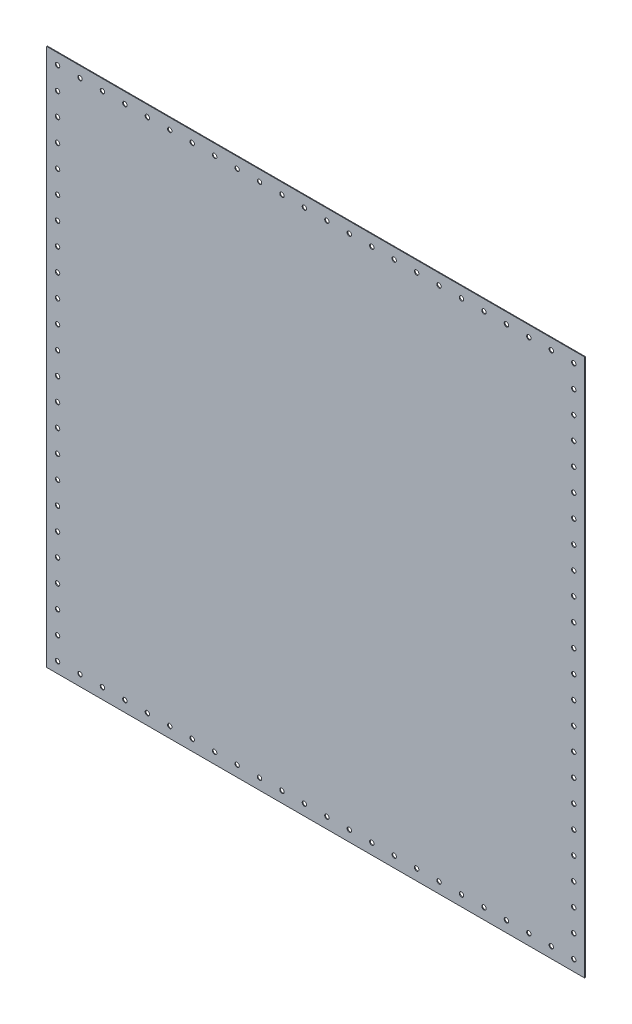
SolidWorks part; units mm, degrees
ref_plane "Front Plane" through (0, 0, 0) normal (0, 0, 1) x (1, 0, 0)
ref_plane "Top Plane" through (0, 0, 0) normal (0, 1, 0) x (1, 0, 0)
ref_plane "Right Plane" through (0, 0, 0) normal (1, 0, 0) x (0, 0, -1)
sketch "Sketch1" plane through (0, 0, 0) normal (0, 0, 1) x (1, 0, 0)
  line L1 (-598.4875, 598.4875) -> (598.4875, 598.4875)
  line L2 (-598.4875, 598.4875) -> (-598.4875, -598.4875)
  line L3 (-598.4875, -598.4875) -> (598.4875, -598.4875)
  line L4 (598.4875, 598.4875) -> (598.4875, -598.4875)
  point P4 (0, 598.4875)
  point P5 (-598.4875, 0)
  dimension "D1" = 1196.975
  dimension "D2" = 1196.975
sketch "Sketch2" plane through (0, 0, 0) normal (0, 0, 1) x (1, 0, 0)
  line L0 (-598.4875, 598.4875) -> (-598.4875, -598.4875) construction
  line L1 (-598.4875, -598.4875) -> (598.4875, -598.4875) construction
  line L2 (598.4875, 598.4875) -> (598.4875, -598.4875) construction
  circle A1 centre (574.3575, -574.3575) radius 4.9022
  circle A2 centre (-574.3575, -574.3575) radius 4.9022
  circle A3 centre (574.3575, -524.4134) radius 4.9022
  circle A4 centre (-574.3575, -524.4134) radius 4.9022
  circle A5 centre (574.3575, -474.4692) radius 4.9022
  circle A6 centre (-574.3575, -474.4692) radius 4.9022
  circle A7 centre (574.3575, -424.5251) radius 4.9022
  circle A8 centre (-574.3575, -424.5251) radius 4.9022
  circle A9 centre (574.3575, -374.581) radius 4.9022
  circle A10 centre (-574.3575, -374.581) radius 4.9022
  circle A11 centre (574.3575, -324.6368) radius 4.9022
  circle A12 centre (-574.3575, -324.6368) radius 4.9022
  circle A13 centre (574.3575, -274.6927) radius 4.9022
  circle A14 centre (-574.3575, -274.6927) radius 4.9022
  circle A15 centre (574.3575, -224.7486) radius 4.9022
  circle A16 centre (-574.3575, -224.7486) radius 4.9022
  circle A17 centre (574.3575, -174.8045) radius 4.9022
  circle A18 centre (-574.3575, -174.8045) radius 4.9022
  circle A19 centre (574.3575, -124.8603) radius 4.9022
  circle A20 centre (-574.3575, -124.8603) radius 4.9022
  circle A21 centre (574.3575, -74.9162) radius 4.9022
  circle A22 centre (-574.3575, -74.9162) radius 4.9022
  circle A23 centre (574.3575, -24.9721) radius 4.9022
  circle A24 centre (-574.3575, -24.9721) radius 4.9022
  circle A25 centre (574.3575, 24.9721) radius 4.9022
  circle A26 centre (-574.3575, 24.9721) radius 4.9022
  circle A27 centre (574.3575, 74.9162) radius 4.9022
  circle A28 centre (-574.3575, 74.9162) radius 4.9022
  circle A29 centre (574.3575, 124.8603) radius 4.9022
  circle A30 centre (-574.3575, 124.8603) radius 4.9022
  circle A31 centre (574.3575, 174.8045) radius 4.9022
  circle A32 centre (-574.3575, 174.8045) radius 4.9022
  circle A33 centre (574.3575, 224.7486) radius 4.9022
  circle A34 centre (-574.3575, 224.7486) radius 4.9022
  circle A35 centre (574.3575, 274.6927) radius 4.9022
  circle A36 centre (-574.3575, 274.6927) radius 4.9022
  circle A37 centre (574.3575, 324.6368) radius 4.9022
  circle A38 centre (-574.3575, 324.6368) radius 4.9022
  circle A39 centre (574.3575, 374.581) radius 4.9022
  circle A40 centre (-574.3575, 374.581) radius 4.9022
  circle A41 centre (574.3575, 424.5251) radius 4.9022
  circle A42 centre (-574.3575, 424.5251) radius 4.9022
  circle A43 centre (574.3575, 474.4692) radius 4.9022
  circle A44 centre (-574.3575, 474.4692) radius 4.9022
  circle A45 centre (574.3575, 524.4134) radius 4.9022
  circle A46 centre (-574.3575, 524.4134) radius 4.9022
  circle A47 centre (574.3575, 574.3575) radius 4.9022
  circle A48 centre (-574.3575, 574.3575) radius 4.9022
  circle A49 centre (-524.4134, -574.3575) radius 4.9022
  circle A50 centre (-524.4134, 574.3575) radius 4.9022
  circle A51 centre (-474.4692, -574.3575) radius 4.9022
  circle A52 centre (-474.4692, 574.3575) radius 4.9022
  circle A53 centre (-424.5251, -574.3575) radius 4.9022
  circle A54 centre (-424.5251, 574.3575) radius 4.9022
  circle A55 centre (-374.581, -574.3575) radius 4.9022
  circle A56 centre (-374.581, 574.3575) radius 4.9022
  circle A57 centre (-324.6368, -574.3575) radius 4.9022
  circle A58 centre (-324.6368, 574.3575) radius 4.9022
  circle A59 centre (-274.6927, -574.3575) radius 4.9022
  circle A60 centre (-274.6927, 574.3575) radius 4.9022
  circle A61 centre (-224.7486, -574.3575) radius 4.9022
  circle A62 centre (-224.7486, 574.3575) radius 4.9022
  circle A63 centre (-174.8045, -574.3575) radius 4.9022
  circle A64 centre (-174.8045, 574.3575) radius 4.9022
  circle A65 centre (-124.8603, -574.3575) radius 4.9022
  circle A66 centre (-124.8603, 574.3575) radius 4.9022
  circle A67 centre (-74.9162, -574.3575) radius 4.9022
  circle A68 centre (-74.9162, 574.3575) radius 4.9022
  circle A69 centre (-24.9721, -574.3575) radius 4.9022
  circle A70 centre (-24.9721, 574.3575) radius 4.9022
  circle A71 centre (24.9721, -574.3575) radius 4.9022
  circle A72 centre (24.9721, 574.3575) radius 4.9022
  circle A73 centre (74.9162, -574.3575) radius 4.9022
  circle A74 centre (74.9162, 574.3575) radius 4.9022
  circle A75 centre (124.8603, -574.3575) radius 4.9022
  circle A76 centre (124.8603, 574.3575) radius 4.9022
  circle A77 centre (174.8045, -574.3575) radius 4.9022
  circle A78 centre (174.8045, 574.3575) radius 4.9022
  circle A79 centre (224.7486, -574.3575) radius 4.9022
  circle A80 centre (224.7486, 574.3575) radius 4.9022
  circle A81 centre (274.6927, -574.3575) radius 4.9022
  circle A82 centre (274.6927, 574.3575) radius 4.9022
  circle A83 centre (324.6368, -574.3575) radius 4.9022
  circle A84 centre (324.6368, 574.3575) radius 4.9022
  circle A85 centre (374.581, -574.3575) radius 4.9022
  circle A86 centre (374.581, 574.3575) radius 4.9022
  circle A87 centre (424.5251, -574.3575) radius 4.9022
  circle A88 centre (424.5251, 574.3575) radius 4.9022
  circle A89 centre (474.4692, -574.3575) radius 4.9022
  circle A90 centre (474.4692, 574.3575) radius 4.9022
  circle A91 centre (524.4134, -574.3575) radius 4.9022
  circle A92 centre (524.4134, 574.3575) radius 4.9022
  dimension "D1" = 24.13
  dimension "D3" = 9.8044
  dimension "D6" = 9.8044
  dimension "D2" = 24.13
  dimension "D4" = 24.13
  dimension "D5" = 24.13
  dimension "D8" = 23
  dimension "D7" = 24
extrude "Boss-Extrude1" add sketch "Sketch1" along normal blind 1.5875
extrude "Cut-Extrude2" cut sketch "Sketch2" along normal through all
